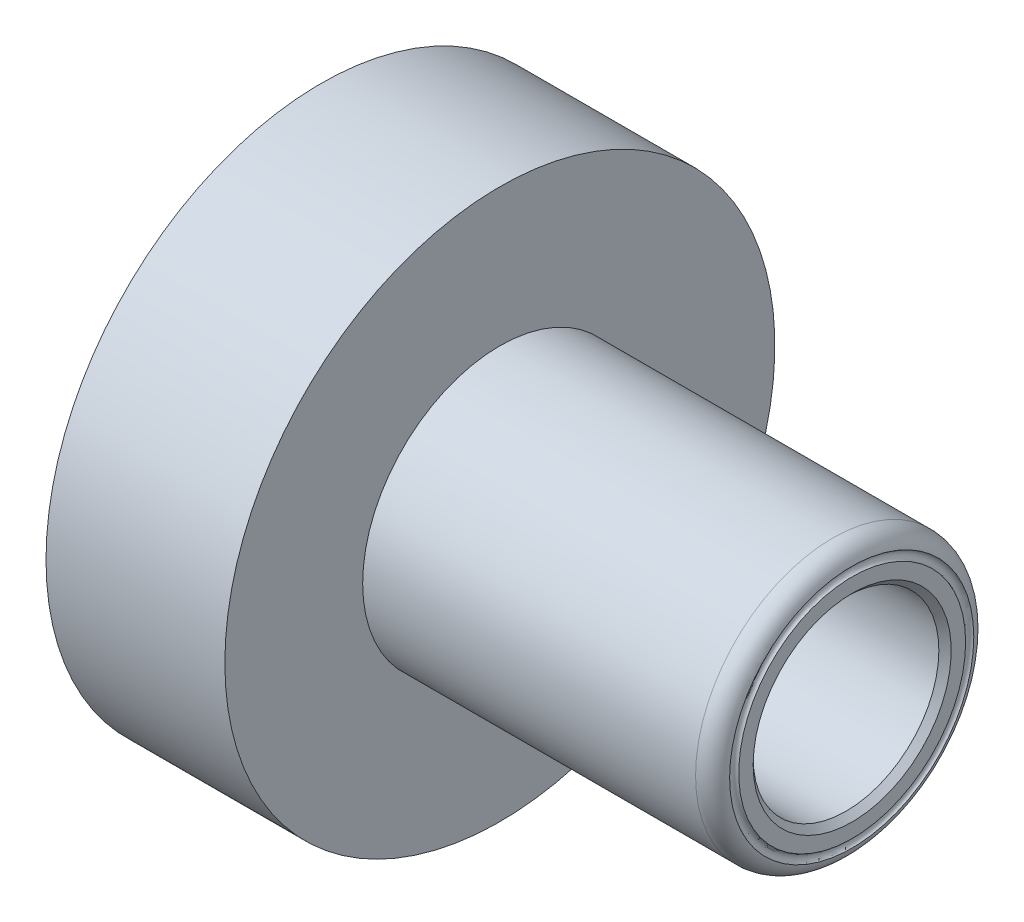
SolidWorks part; units mm, degrees
ref_plane "Front Plane" through (0, 0, 0) normal (0, 0, 1) x (1, 0, 0)
ref_plane "Top Plane" through (0, 0, 0) normal (0, 1, 0) x (1, 0, 0)
ref_plane "Right Plane" through (0, 0, 0) normal (1, 0, 0) x (0, 0, -1)
sketch "Sketch1" plane through (0, 0, 0) normal (0, 0, 1) x (1, 0, 0)
  line L0 (0, 0) -> (102.3864, 0) construction
  line L1 (0, 8.128) -> (0, 22.225)
  line L2 (0, 22.225) -> (14.4526, 22.225)
  line L3 (14.4526, 22.225) -> (14.4526, 11.0871)
  line L4 (14.4526, 11.0871) -> (41.356, 11.0871)
  line L5 (42.926, 9.5171) -> (42.926, 0)
  line L6 (42.926, 0) -> (28.067, 0)
  line L7 (0, 8.128) -> (28.067, 8.128)
  line L8 (28.067, 8.128) -> (28.067, 0)
  arc A0 (42.926, 9.5171) -> (41.356, 11.0871) centre (41.356, 9.5171) ccw
  dimension "D5" = 1.57
  dimension "D1" = 14.4526
  dimension "D2" = 44.45
  dimension "D3" = 28.067
  dimension "D4" = 16.256
  dimension "D6" = 42.926
  dimension "D7" = 22.1742
revolve "Revolve1" add sketch "Sketch1" angle 360 about L0
sketch "Sketch2" plane through (0, 0, 0) normal (-1, 0, 0) x (0, 0, 1)
  line L0 (0, 0) -> (0, 9.7644) construction
  circle A0 centre (-12.7, 0) radius 3.2004
  circle A1 centre (12.7, 0) radius 3.2004
  dimension "D2" = 6.4008
  dimension "D1" = 25.4
extrude "Cut-Extrude1" cut sketch "Sketch2" against normal blind 7.9502
sketch "Sketch3" plane through (42.926, 0, 0) normal (1, 0, 0) x (0, 0, -1)
  circle A0 centre (0, 0) radius 7.505
  dimension "D1" = 15.01
extrude "Cut-Extrude2" cut sketch "Sketch3" against normal through all
chamfer "Chamfer1" distance 0.5 angle 45 1 edges at (42.926, 0, -7.505)
sketch "Sketch4" plane through (0, 0, 0) normal (0, 0, 1) x (1, 0, 0)
  line L0 (0, 0) -> (50.8971, 0) construction
  line L1 (0, 22.225) -> (0, -22.225) construction
  circle A0 centre (43.057, 9.525) radius 0.381
  dimension "D1" = 43.057
  dimension "D2" = 9.525
  dimension "D3" = 0.381
revolve "Cut-Revolve1" cut sketch "Sketch4" angle 360 about L0
